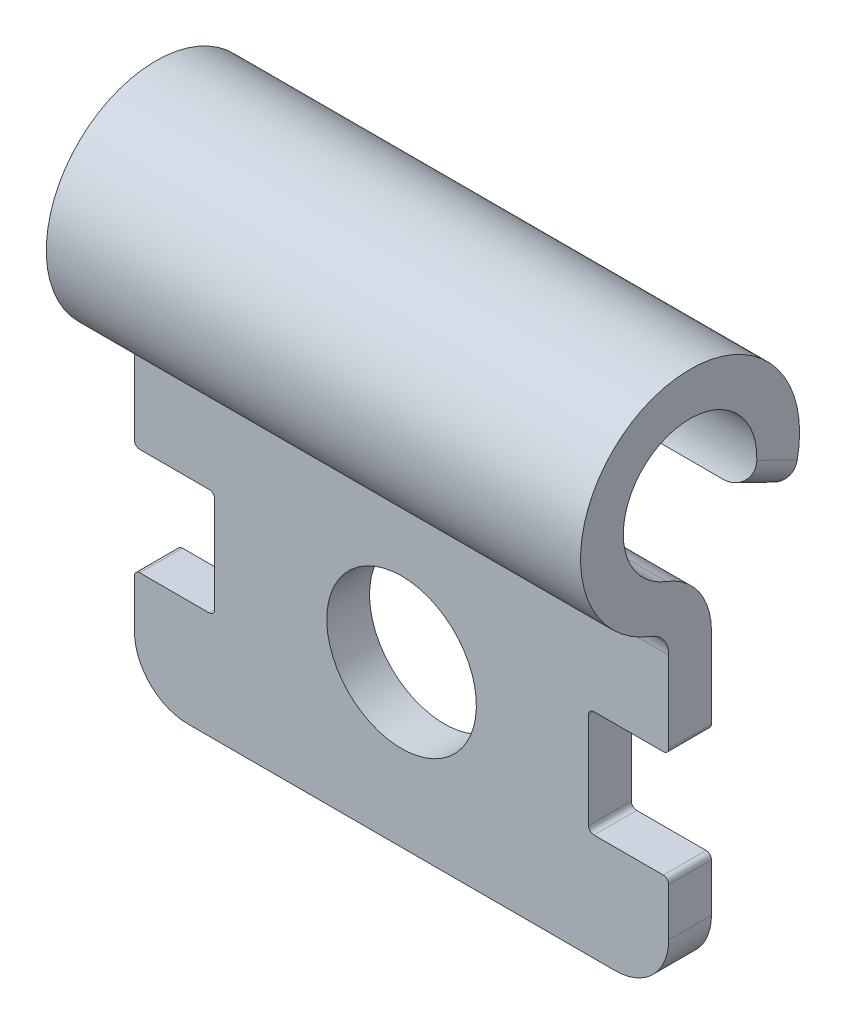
SolidWorks part; units mm, degrees
ref_plane "Front Plane" through (0, 0, 0) normal (0, 0, 1) x (1, 0, 0)
ref_plane "Top Plane" through (0, 0, 0) normal (0, 1, 0) x (1, 0, 0)
ref_plane "Right Plane" through (0, 0, 0) normal (1, 0, 0) x (0, 0, -1)
sketch "Sketch1" plane through (0, 0, 0) normal (1, 0, 0) x (0, 0, -1)
  line L1 (-0.4, -2.3859) -> (-0.4, -8)
  arc A0 (1.8426, -0.8986) -> (-0.7235, -1.9181) centre (0, 0) ccw
  arc A1 (-0.4, -2.3859) -> (-0.7235, -1.9181) centre (-0.9, -2.3859) ccw
  point P5 (1.8426, -0.8986)
  dimension "D" = 4.1
  dimension "D4" = 0.5
  dimension "C" = 8
  dimension "t/2" = 0.4
extrude "Extrude-Thin1" add sketch "Sketch1" along normal blind 10 thin
sketch "Sketch2" plane through (0, 0, -0.4) normal (0, 0, -1) x (-1, 0, 0)
  line L0 (-5, -8) -> (-5, -4.3792) construction
  line L1 (-10, -8) -> (0, -8) construction
  circle A1 centre (-5, -5) radius 1.4
  dimension "D3" = 2.8
  dimension "E" = 5
extrude "Cut-Extrude1" cut sketch "Sketch2" against normal through all
sketch "Sketch3" plane through (0, 0, 0.4) normal (0, 0, 1) x (1, 0, 0)
  line L0 (0, -2.3859) -> (0, -8) construction
  line L1 (0, -6) -> (1.5, -6)
  line L2 (0, -6) -> (0, -4)
  line L3 (0, -4) -> (1.5, -4)
  line L4 (1.5, -6) -> (1.5, -4)
  line L5 (5, -2.6931) -> (5, -7.2015) construction
  line L6 (1.5, -5) -> (8.5, -5) construction
  line L7 (8.5, -6) -> (8.5, -4)
  line L8 (10, -4) -> (8.5, -4)
  line L9 (10, -6) -> (10, -4)
  line L10 (10, -6) -> (8.5, -6)
  point P11 (1.5, -5)
  point P16 (8.5, -5)
  dimension "X" = 1.5
  dimension "Y" = 2
extrude "Cut-Extrude2" cut sketch "Sketch3" against normal through all
fillet "Fillet1" radius 0.5 2 edges at (0, -0.7233, -1.483) (10, -0.7233, -1.483)
fillet "Fillet2" radius 1 2 edges at (10, -8, 0) (0, -8, 0)
fillet "Fillet3" radius 0.1 8 edges at (10, -6, 0) (8.5, -6, 0) (8.5, -4, 0) (10, -4, 0) (0, -6, 0) (1.5, -6, 0) (1.5, -4, 0) (0, -4, 0)
